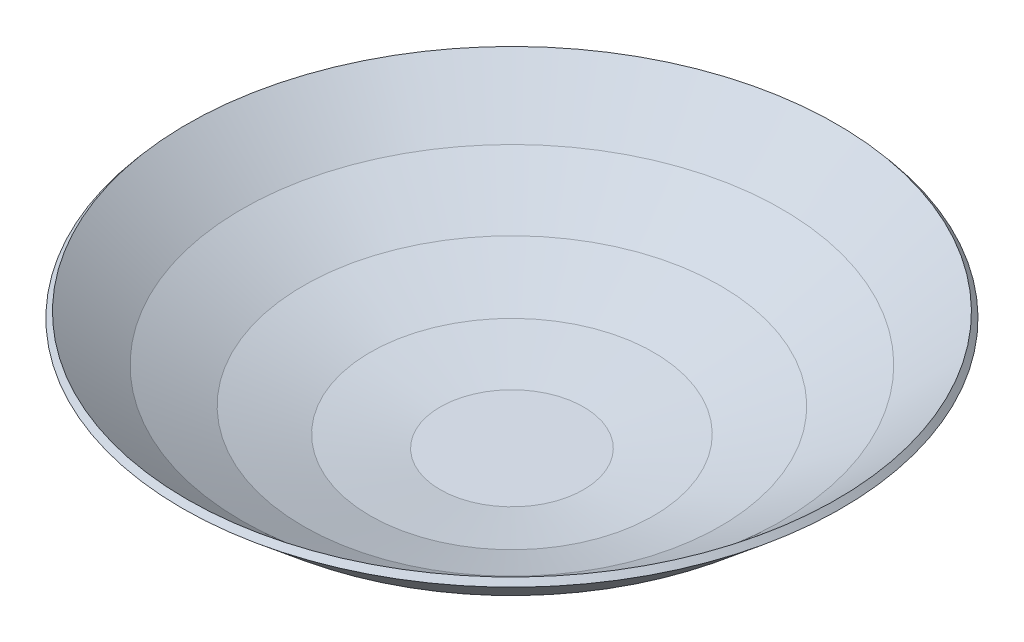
SolidWorks part; units mm, degrees
ref_plane "Front Plane" through (0, 0, 0) normal (0, 0, 1) x (1, 0, 0)
ref_plane "Top Plane" through (0, 0, 0) normal (0, 1, 0) x (1, 0, 0)
ref_plane "Right Plane" through (0, 0, 0) normal (1, 0, 0) x (0, 0, -1)
sketch "Sketch2" plane through (0, 0, 0) normal (0, 0, 1) x (1, 0, 0)
  line L0 (0, 0) -> (9.9125, 0)
  line L1 (10.0862, 0.0152) -> (19.7619, 1.7213)
  line L2 (19.9303, 1.7664) -> (29.1628, 5.1268)
  line L3 (29.3208, 5.2004) -> (37.8295, 10.1129)
  line L4 (37.9723, 10.2129) -> (45.5657, 16.5846)
  line L5 (0, 1) -> (9.9125, 1)
  line L6 (9.9125, 1) -> (19.5883, 2.7061)
  line L7 (19.5883, 2.7061) -> (28.8208, 6.0665)
  line L8 (28.8208, 6.0665) -> (37.3295, 10.979)
  line L9 (37.3295, 10.979) -> (44.9229, 17.3506)
  line L10 (44.9229, 17.3506) -> (45.5657, 16.5846)
  line L11 (0, 1) -> (0, 0)
  arc A0 (37.8295, 10.1129) -> (37.9723, 10.2129) centre (37.3295, 10.979) ccw
  arc A1 (29.1628, 5.1268) -> (29.3208, 5.2004) centre (28.8208, 6.0665) ccw
  arc A2 (19.7619, 1.7213) -> (19.9303, 1.7664) centre (19.5883, 2.7061) ccw
  arc A3 (9.9125, 0) -> (10.0862, 0.0152) centre (9.9125, 1) ccw
  arc A4 (9.9125, 1) -> (9.9125, 1) centre (9.9125, 1) ccw
  arc A5 (19.5883, 2.7061) -> (19.5883, 2.7061) centre (19.5883, 2.7061) ccw
  arc A6 (28.8208, 6.0665) -> (28.8208, 6.0665) centre (28.8208, 6.0665) ccw
  arc A7 (37.3295, 10.979) -> (37.3295, 10.979) centre (37.3295, 10.979) ccw
  point P8 (37.9053, 10.1567)
  point P11 (29.245, 5.1567)
  point P15 (19.8481, 1.7365)
  point P18 (10, 0)
  dimension "D4" = 10
  dimension "D5" = 10
  dimension "D8" = 170
  dimension "D10" = 1
  dimension "D1" = 10
  dimension "D2" = 10
  dimension "D3" = 10
  dimension "D6" = 170
  dimension "D7" = 170
  dimension "D9" = 170
  dimension "D11" = 1
revolve "Revolve1" add sketch "Sketch2" angle 360 about L11
